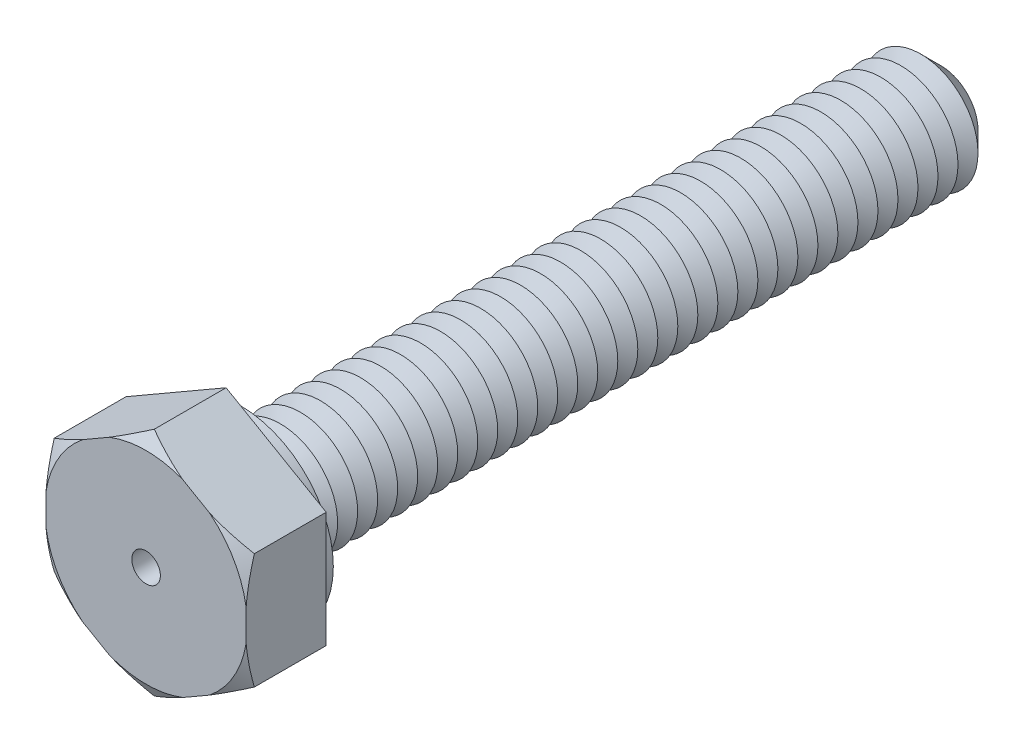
SolidWorks part; units mm, degrees
ref_plane "Front Plane" through (0, 0, 0) normal (0, 0, 1) x (1, 0, 0)
ref_plane "Top Plane" through (0, 0, 0) normal (0, 1, 0) x (1, 0, 0)
ref_plane "Right Plane" through (0, 0, 0) normal (1, 0, 0) x (0, 0, -1)
sketch "Sketch2" plane through (0, 0, 0) normal (0, 0, 1) x (1, 0, 0)
  line L1 (0, 4.0415) -> (-3.5, 2.0207)
  line L2 (-3.5, 2.0207) -> (-3.5, -2.0207)
  line L3 (-3.5, -2.0207) -> (0, -4.0415)
  line L4 (0, -4.0415) -> (3.5, -2.0207)
  line L5 (3.5, -2.0207) -> (3.5, 2.0207)
  line L6 (3.5, 2.0207) -> (0, 4.0415)
  circle A0 centre (0, 0) radius 3.5 construction
  dimension "D1" = 7
extrude "Boss-Extrude1" add sketch "Sketch2" along normal blind 2.8
sketch "Sketch3" plane through (0, 0, 0) normal (0, 0, -1) x (-1, 0, 0)
  circle A0 centre (0, 0) radius 2
  dimension "D1" = 4
extrude "Boss-Extrude2" add sketch "Sketch3" along normal blind 25
sketch "Sketch4" plane through (0, 0, 0) normal (0, 0, -1) x (-1, 0, 0)
  circle A0 centre (0, 0) radius 3.25
  dimension "D1" = 6.5
extrude "Boss-Extrude3" add sketch "Sketch4" along normal blind 0.5
sketch "Sketch5" plane through (0, 0, 0) normal (1, 0, 0) x (0, 0, -1)
  line L0 (-3.2117, 0) -> (6.3192, 0) construction
chamfer "Chamfer1" distance 0.7 angle 45 1 edges at (-2, 0, -25)
sketch "Sketch6" plane through (0, 0, 0) normal (1, 0, 0) x (0, 0, -1)
  line L0 (0.5, 2) -> (0.85, 1.3938)
  line L1 (0.85, 1.3938) -> (1.2, 2)
  line L2 (24.3, 2) -> (0.5, 2) construction
  line L3 (1.2, 2) -> (0.5, 2)
  dimension "D1" = 0.7
revolve "Cut-Revolve1" cut sketch "Sketch6" angle 360 about L0
pattern_linear "LPattern1" count 34 spacing 0.7 along (0, 0, -1) of "Cut-Revolve1"
sketch "Sketch7" plane through (0, 0, 0) normal (1, 0, 0) x (0, 0, -1)
  line L0 (-2.8, 4.0415) -> (-2.8, 3.5415)
  line L1 (-2.8, 2.0207) -> (-2.8, 4.0415) construction
  line L2 (-2.8, 3.5415) -> (-2.5113, 4.0415)
  line L3 (-2.8, 4.0415) -> (0, 4.0415) construction
  line L4 (-2.5113, 4.0415) -> (-2.8, 4.0415)
  dimension "D1" = 0.5
  dimension "D2" = 30
revolve "Cut-Revolve2" cut sketch "Sketch7" angle 360 about L0
sketch "Sketch8" plane through (0, 0, 2.8) normal (0, 0, 1) x (1, 0, 0)
  circle A0 centre (0, 0) radius 0.5
  dimension "D1" = 1
extrude "Cut-Extrude1" cut sketch "Sketch8" against normal up to surface (27.8 mm away)
